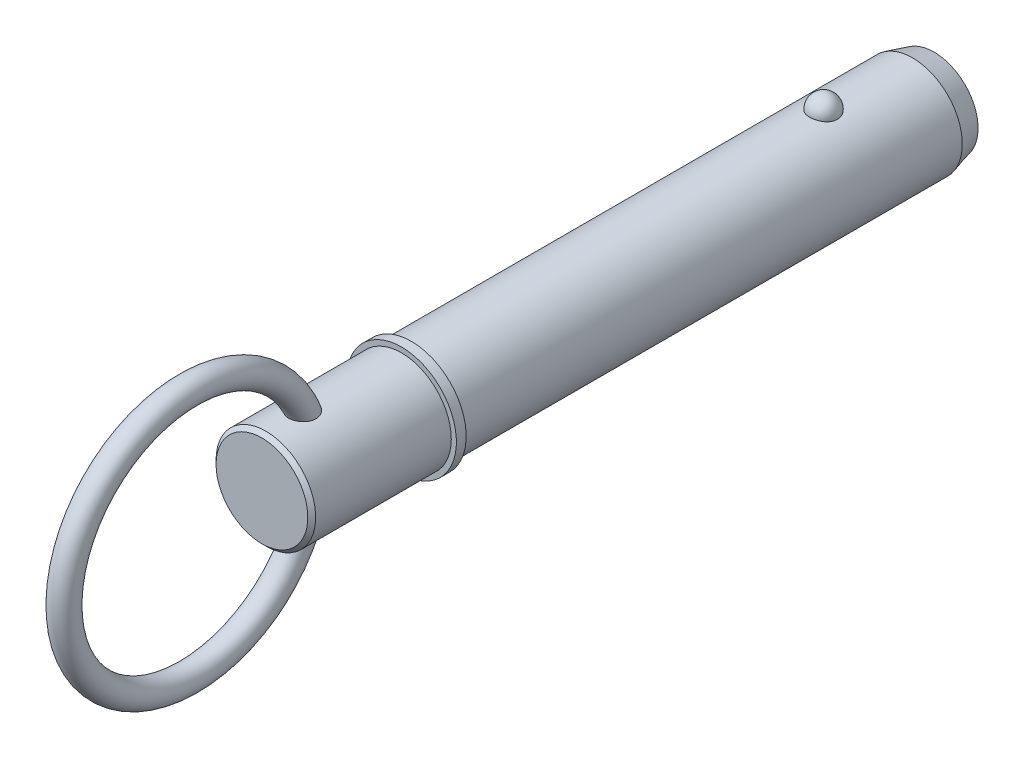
SolidWorks part; units mm, degrees
ref_plane "Front Plane" through (0, 0, 0) normal (0, 0, 1) x (1, 0, 0)
ref_plane "Top Plane" through (0, 0, 0) normal (0, 1, 0) x (1, 0, 0)
ref_plane "Right Plane" through (0, 0, 0) normal (1, 0, 0) x (0, 0, -1)
sketch "Sketch2" plane through (0, 0, 0) normal (0, 0, 1) x (1, 0, 0)
  circle A0 centre (0, 0) radius 12.7
  point P3 (0, 12.7)
  dimension "D1" = 25.4
extrude "Boss-Extrude1" add sketch "Sketch2" along normal blind 101.6
sketch "Sketch3" plane through (0, 0, 0) normal (0, 0, -1) x (-1, 0, 0)
  circle A0 centre (0, 0) radius 12.7
  dimension "D1" = 25.4
extrude "Boss-Extrude2" add sketch "Sketch3" along normal blind 31.75
chamfer "Chamfer1" distance 5.5 angle 15 1 edges at (-12.7, 0, -31.75)
sketch "Sketch18" plane through (0, 0, 0) normal (1, 0, 0) x (0, 0, -1)
  line L0 (26.25, 12.7) -> (-101.6, 12.7) construction
  line L1 (3.56, 16.26) -> (3.56, 9.14)
  line L2 (-101.6, -12.7) -> (26.25, -12.7) construction
  arc A0 (3.56, 16.26) -> (3.56, 9.14) centre (3.56, 12.7) ccw
  point P4 (0, 12.7)
  dimension "D1" = 28.96
revolve "Revolve1" add sketch "Sketch18" angle 360 about L1
sketch "Sketch19" plane through (0, 0, 0) normal (1, 0, 0) x (0, 0, -1)
  line L0 (-33.7288, 0) -> (-46.4542, 0) construction
sketch "Sketch20" plane through (0, 0, 0) normal (1, 0, 0) x (0, 0, -1)
  line L0 (-101.6, 0) -> (-101.6, 14)
  line L1 (-101.6, 12.7) -> (-101.6, -12.7) construction
  line L2 (-101.6, 14) -> (-104.1, 14)
  line L3 (-104.1, 14) -> (-104.1, 0)
  line L4 (-33.7288, 0) -> (-46.4542, 0) construction
  line L5 (-104.1, 0) -> (-101.6, 0)
  dimension "D1" = 14
  dimension "D2" = 2.5
revolve "Revolve2" add sketch "Sketch20" angle 360 about L0
sketch "Sketch21" plane through (0, 0, 101.6) normal (0, 0, -1) x (-1, 0, 0)
  circle A0 centre (0, 0) radius 12.7
  dimension "D1" = 25.4
extrude "Boss-Extrude3" add sketch "Sketch21" against normal blind 38.1
chamfer "Chamfer2" distance 1 angle 45 1 edges at (-12.7, 0, 139.7)
sketch "Sketch23" plane through (0, 0, 0) normal (1, 0, 0) x (0, 0, -1)
  line L0 (-139.7, 11.7) -> (-139.7, -11.7) construction
  circle A0 centre (-158.45, 0) radius 31.75
  point P2 (-126.7, 0)
  dimension "D1" = 63.5
  dimension "D2" = 13
sketch "Sketch24" plane through (0, 0, 0) normal (0, 1, 0) x (1, 0, 0)
  circle A0 centre (0, -126.7) radius 3.25
  dimension "D1" = 6.5
sweep "Sweep1" add profiles "Sketch24" path "Sketch23"
